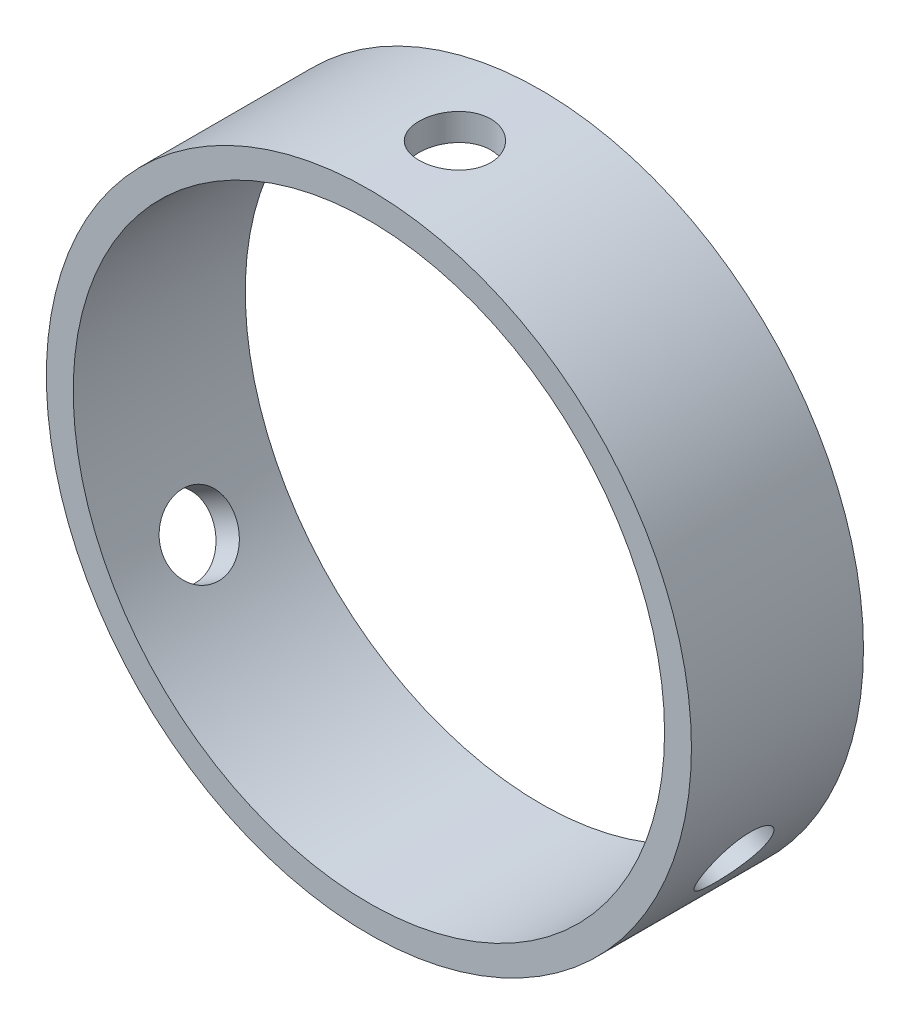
SolidWorks part; units mm, degrees
ref_plane "Front Plane" through (0, 0, 0) normal (0, 0, 1) x (1, 0, 0)
ref_plane "Top Plane" through (0, 0, 0) normal (0, 1, 0) x (1, 0, 0)
ref_plane "Right Plane" through (0, 0, 0) normal (1, 0, 0) x (0, 0, -1)
sketch "Sketch1" plane through (0, 0, 0) normal (0, 0, 1) x (1, 0, 0)
  circle A0 centre (0, 0) radius 57.15
  circle A1 centre (0, 0) radius 52.3875
  dimension "D1" = 104.775
  dimension "D2" = 114.3
extrude "Extrude1" add sketch "Sketch1" along normal mid plane 30.48
ref_plane "Plane1" through (0, 57.15, 0) normal (0, 1, 0) x (-1, 0, 0)
sketch "Sketch2" plane through (0, 57.15, 0) normal (0, 1, 0) x (-1, 0, 0)
  circle A0 centre (0, 0) radius 6.35
  dimension "D1" = 12.7
extrude "Cut-Extrude1" cut sketch "Sketch2" against normal up to next
pattern_circular "CirPattern1" count 3 every 120 about axis through (0, 0, 15.24) along (0, 0, -1) of "Cut-Extrude1"
